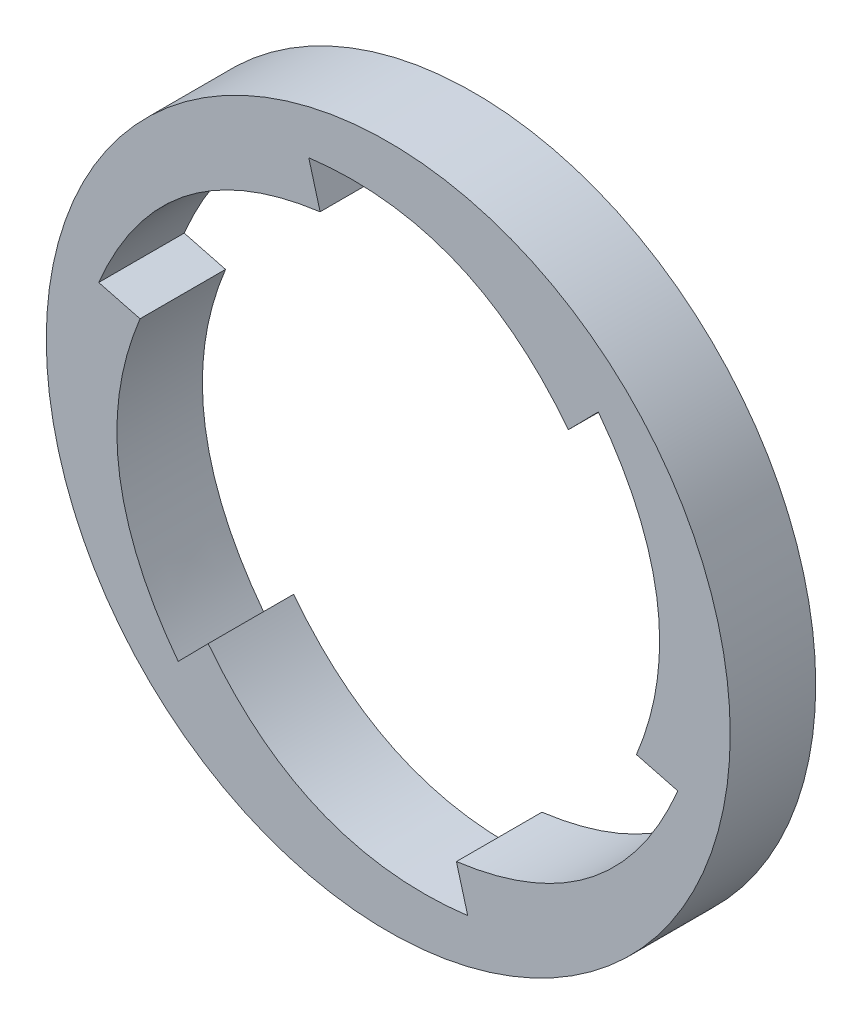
SolidWorks part; units mm, degrees
ref_plane "Front Plane" through (0, 0, 0) normal (0, 0, 1) x (1, 0, 0)
ref_plane "Top Plane" through (0, 0, 0) normal (0, 1, 0) x (1, 0, 0)
ref_plane "Right Plane" through (0, 0, 0) normal (1, 0, 0) x (0, 0, -1)
sketch "Sketch1" plane through (0, 0, 0) normal (0, 0, 1) x (1, 0, 0)
  line L0 (0, 0) -> (-6.7481, 24.4872) construction
  line L1 (0, 0) -> (17.8325, 18.0876) construction
  line L2 (0, 0) -> (24.5806, -6.3996) construction
  line L3 (0, 0) -> (6.7481, -24.4872) construction
  line L4 (0, 0) -> (-17.8325, -18.0876) construction
  line L5 (0, 0) -> (-24.5806, 6.3996) construction
  line L6 (-5.0611, 18.3654) -> (-5.9035, 21.4224) construction
  line L7 (13.3744, 13.5657) -> (15.6006, 15.8238) construction
  line L8 (18.4354, -4.7997) -> (21.5041, -5.5986) construction
  line L9 (5.0611, -18.3654) -> (5.9035, -21.4224) construction
  line L10 (-13.3744, -13.5657) -> (-15.6006, -15.8238) construction
  line L11 (-18.4354, 4.7997) -> (-21.5041, 5.5986) construction
  line L12 (-19.635, 9.2333) -> (7.6902, 2.1192) construction
  line L13 (-1.8212, 21.6211) -> (5.6804, -5.6003) construction
  line L14 (17.8138, 12.3877) -> (-2.0098, -7.7195) construction
  line L15 (19.635, -9.2333) -> (-7.6902, -2.1192) construction
  line L16 (1.8212, -21.6211) -> (-5.6804, 5.6003) construction
  line L17 (-17.8138, -12.3877) -> (2.0098, 7.7195) construction
  line L18 (-5.6804, 5.6003) -> (-7.6902, -2.1192) construction
  line L19 (-7.6902, -2.1192) -> (-2.0098, -7.7195) construction
  line L20 (-2.0098, -7.7195) -> (5.6804, -5.6003) construction
  line L21 (5.6804, -5.6003) -> (7.6902, 2.1192) construction
  line L22 (7.6902, 2.1192) -> (2.0098, 7.7195) construction
  line L23 (2.0098, 7.7195) -> (-5.6804, 5.6003) construction
  line L24 (-18.4354, 4.7997) -> (-21.5041, 5.5986)
  line L25 (-15.6006, -15.8238) -> (-13.3744, -13.5657)
  line L26 (5.9035, -21.4224) -> (5.0611, -18.3654)
  line L27 (21.5041, -5.5986) -> (18.4354, -4.7997)
  line L28 (15.6006, 15.8238) -> (13.3744, 13.5657)
  line L29 (-5.9035, 21.4224) -> (-5.0611, 18.3654)
  circle A0 centre (0, 0) radius 25.4
  circle A1 centre (0, 0) radius 19.05 construction
  circle A2 centre (0, 0) radius 22.221 construction
  circle A3 centre (0, 0) radius 12.7 construction
  spline S0 degree 2 poles (-5.9035, 21.4224) (6.1634, 22.9446) (13.3744, 13.5657) knots 0 0 0 1 1 1
  spline S1 degree 2 poles (15.6006, 15.8238) (22.9523, 6.1346) (18.4354, -4.7997) knots 0 0 0 1 1 1
  spline S2 degree 2 poles (21.5041, -5.5986) (16.7889, -16.81) (5.0611, -18.3654) knots 0 0 0 1 1 1
  spline S3 degree 2 poles (5.9035, -21.4224) (-6.1634, -22.9446) (-13.3744, -13.5657) knots 0 0 0 1 1 1
  spline S4 degree 2 poles (-15.6006, -15.8238) (-22.9523, -6.1346) (-18.4354, 4.7997) knots 0 0 0 1 1 1
  spline S5 degree 2 poles (-21.5041, 5.5986) (-16.7889, 16.81) (-5.0611, 18.3654) knots 0 0 0 1 1 1
  spline S6 degree 2 poles (-21.5041, 5.5986) (-20.7154, 7.4917) (-19.635, 9.2333) knots 0 0 0 1 1 1 construction
  dimension "D1" = 6
  dimension "D2" = 6
  dimension "D3" = 6.35
extrude "Boss-Extrude1" add sketch "Sketch1" along normal blind 6.35
